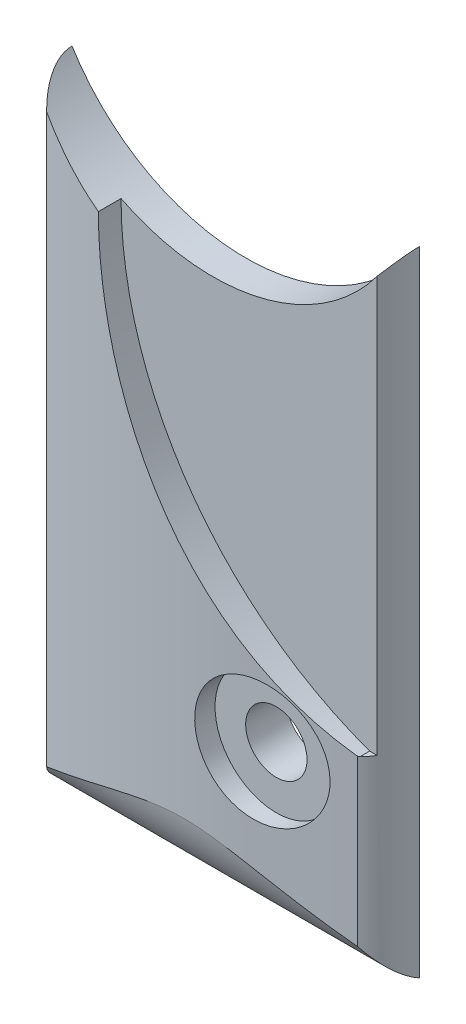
SolidWorks part; units mm, degrees
ref_plane "Plan1" through (0, 0, 0) normal (0, 0, 1) x (1, 0, 0)
ref_plane "Plan2" through (0, 0, 0) normal (0, 1, 0) x (1, 0, 0)
ref_plane "Plan3" through (0, 0, 0) normal (1, 0, 0) x (0, 0, -1)
sketch "Esquisse1" plane through (0, 0, 0) normal (0, 0, 1) x (1, 0, 0)
  line L0 (-29, -11) -> (-29, -42)
  line L1 (-29, -42) -> (-12, -42)
  line L2 (-12, -42) -> (-12, -11)
  arc A0 (-29, -11) -> (-12, -11) centre (-20.5, -5.7322) ccw
  circle A1 centre (-17, -33.5) radius 1.5
  dimension "D4" = 10
  dimension "D5" = 3
  dimension "D1" = 17
  dimension "D2" = 31
  dimension "D3" = 31
  dimension "D6" = 8.5
  dimension "D7" = 5
extrude "Base-Extrusion" add sketch "Esquisse1" along normal blind 3
sketch "Esquisse2" plane through (0, 0, 3) normal (0, 0, 1) x (1, 0, 0)
  circle A0 centre (-17, -33.5) radius 3
  dimension "D1" = 6
extrude "Enlèv. mat.-Extru.1" cut sketch "Esquisse2" against normal blind 1
fillet "Congé1" radius 3 6 edges at (-12, -26.5, 3) (-29, -26.5, 3) (-12, -11, 1.5) (-12, -42, 1.5) (-29, -42, 1.5) (-29, -11, 1.5)
sketch "Esquisse4" plane through (0, -42, 0) normal (0, -1, 0) x (1, 0, 0)
  line L0 (-26, 3) -> (-15, 3) construction
  line L1 (-28.0834, 2.1585) -> (-28, 5)
  line L2 (-28, 5) -> (-12.8938, 4.5564)
  line L3 (-12.8938, 4.5564) -> (-12.8938, 2.1363)
  arc A0 (-12.8938, 2.1363) -> (-28.0834, 2.1585) centre (-20.5374, -31.2561) ccw
  arc A1 (-12, 0) -> (-15, 3) centre (-15, 0) ccw construction
  arc A2 (-26, 3) -> (-29, 0) centre (-26, 0) ccw construction
extrude "Enlèv. mat.-Extru.2" cut sketch "Esquisse4" against normal through all
ref_plane "Plan4" through (0, 0, 3.1) normal (0, 0, 1) x (1, 0, 0)
sketch "Esquisse6" plane through (0, 0, 3.1) normal (0, 0, 1) x (1, 0, 0)
  line L0 (-29, -11) -> (-29, -42) construction
  line L1 (-12.8938, -42) -> (-12, -42) construction
  line L2 (-12.832, -32) -> (-10, -32)
  line L3 (-10, -32) -> (-10, -7)
  line L4 (-10, -7) -> (-25, -14.6625)
  arc A0 (-25, -14.6625) -> (-12.832, -32) centre (-6.5644, -14.6625) ccw
  arc A1 (-28.0834, -12.2507) -> (-12.8938, -12.2242) centre (-20.5, -5.7322) ccw construction
  dimension "D3" = 25
  dimension "D1" = 4
  dimension "D2" = 10
extrude "Enlèv. mat.-Extru.3" cut sketch "Esquisse6" against normal blind 1.5
sketch "Esquisse7" plane through (0, 0, 0) normal (1, 0, 0) x (0, 0, -1)
  line L0 (-3.1, 50) -> (-3.1, -50) construction
  line L1 (-3.1, -37.3826) -> (-4.7278, -37.3826)
  line L2 (-4.7278, -37.3826) -> (-4, -43)
  line L3 (-4, -43) -> (0, -43)
  line L4 (0, -43) -> (0, -42)
  arc A0 (0, -42) -> (-3.1, -37.3826) centre (2.8642, -36.7278) cw
  dimension "D1" = 6
extrude "Enlèv. mat.-Extru.4" cut sketch "Esquisse7" against normal through all
